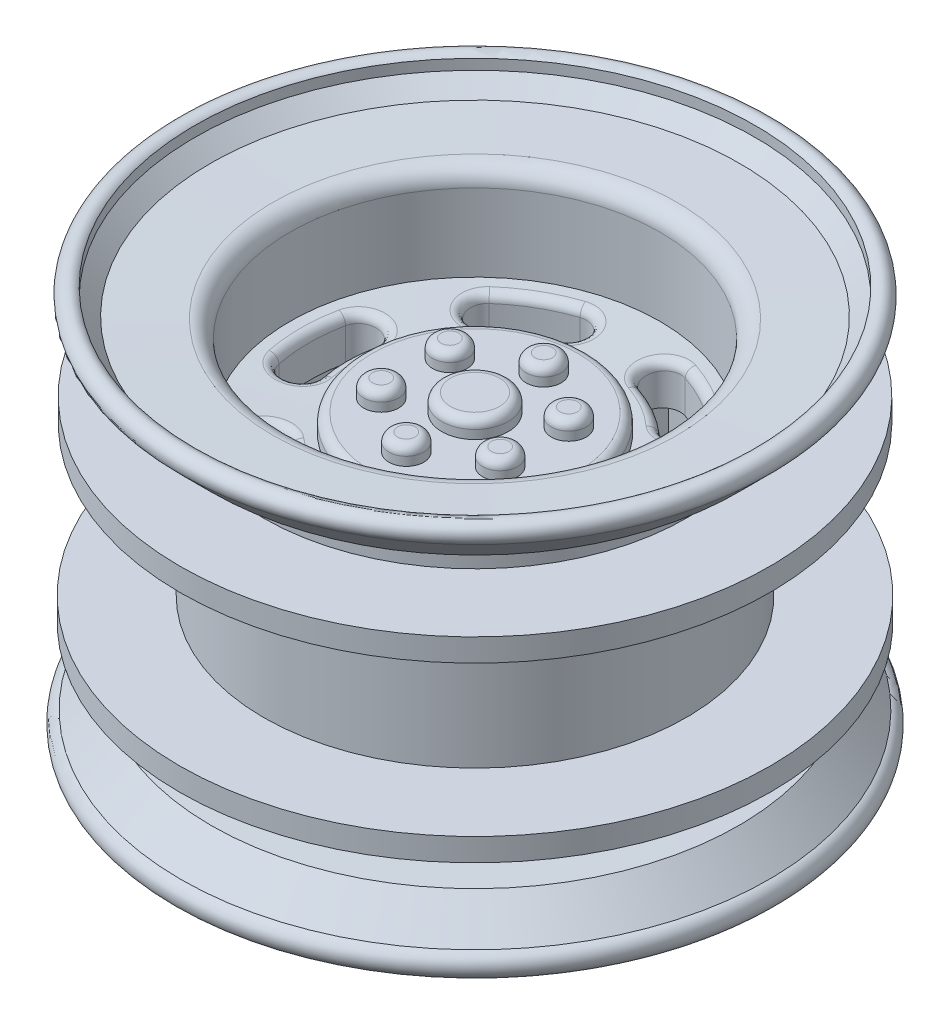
SolidWorks part; units mm, degrees
ref_plane "Plan1" through (0, 0, 0) normal (0, 0, 1) x (1, 0, 0)
ref_plane "Plan2" through (0, 0, 0) normal (0, 1, 0) x (1, 0, 0)
ref_plane "Plan3" through (0, 0, 0) normal (1, 0, 0) x (0, 0, -1)
sketch "Esquisse1" plane through (0, 0, 0) normal (0, 0, 1) x (1, 0, 0)
  line L0 (10.5795, 4) -> (6.3795, 3.7799)
  line L1 (11.5446, 9.4162) -> (15.1342, 9.5415)
  line L2 (15.1342, 9.5415) -> (16, 10.4073)
  line L3 (12.0795, -4.2837) -> (12.0795, 0)
  line L4 (16.8877, -4.2698) -> (12.0795, -4.2837)
  line L5 (16.8915, -5.5698) -> (16.8877, -4.2698)
  line L6 (16.8473, 10.1502) -> (15.0795, 8.3825)
  line L7 (15.0795, 8.3825) -> (12.0795, 8.3825)
  line L8 (12.0795, 8.3825) -> (12.0795, 5.5825)
  line L9 (12.0795, 5.5825) -> (16.8473, 5.5825)
  line L10 (16.8473, 5.5825) -> (16.8473, 4.2825)
  line L11 (16.8473, 4.2825) -> (12.0795, 4.2825)
  line L12 (12.0795, 4.2825) -> (12.0795, 0)
  line L13 (12.2228, -5.5833) -> (16.8915, -5.5698)
  line L14 (12.2228, -8.0833) -> (12.2228, -5.5833)
  line L15 (15.0738, -8.1338) -> (12.2228, -8.0833)
  line L16 (10.5795, 0) -> (10.5795, 1.604)
  line L17 (16.81, -9.9325) -> (15.0738, -8.1338)
  line L18 (14.5201, -9.52) -> (15.9988, -10.9987)
  line L19 (11.5446, -9.4161) -> (14.5201, -9.52)
  line L20 (10.5795, 0) -> (10.5795, -8.4167)
  line L21 (4, 1.604) -> (4, -17.9)
  line L22 (4, 1.604) -> (10.5795, 1.604)
  line L23 (6.3795, 3.7799) -> (6.353, 4.7795)
  line L24 (6.353, 4.7795) -> (0.0524, 4.7795)
  line L25 (0.0524, 4.7795) -> (0.0524, -17.9)
  line L26 (0.0524, -17.9) -> (4, -17.9)
  line L27 (10.5795, 4) -> (10.5795, 8.4168)
  line L28 (16, 11) -> (16, 10.4073)
  arc A0 (16.8473, 10.1502) -> (16, 11) centre (16.423, 10.5745) ccw
  arc A1 (16.81, -9.9325) -> (15.9988, -10.9987) centre (16.5965, -10.6118) cw
  arc A2 (10.5795, -8.4167) -> (11.5446, -9.4161) centre (11.5795, -8.4167) ccw
  arc A3 (10.5795, 8.4168) -> (11.5446, 9.4162) centre (11.5795, 8.4168) cw
  point P27 (10.5795, 9.3825)
  dimension "D6" = 0.6
  dimension "D14" = 1
  dimension "D15" = 1
  dimension "D1" = 135
  dimension "D2" = 2.5
  dimension "D3" = 3
  dimension "D4" = 2.8
  dimension "D5" = 1.3
  dimension "D7" = 2
  dimension "D8" = 1.5
  dimension "D9" = 11
  dimension "D10" = 16
  dimension "D11" = 1
  dimension "D12" = 1.3
  dimension "D13" = 4.2837
  dimension "D16" = 7
  dimension "D17" = 1
  dimension "D18" = 87
  dimension "D19" = 4
  dimension "D20" = 8.4167
  dimension "D21" = 4.2
  dimension "D22" = 28.9
  dimension "D23" = 2.5
ref_axis "Axe1" through (0, 50, 0) along (0, -1, 0)
revolve "Révolution2" add sketch "Esquisse1" angle 360 about axis through (0, 50, 0) along (0, -1, 0)
sketch "Esquisse3" plane through (0, 4.7795, 0) normal (0, 1, 0) x (-1, 0, 0)
  circle A0 centre (0, 0) radius 1.9
  dimension "D1" = 3.8
extrude "Extrusion1" add sketch "Esquisse3" along normal blind 1
sketch "Esquisse4" plane through (0, 4.7795, 0) normal (0, 1, 0) x (-1, 0, 0)
  circle A0 centre (0, -3.9244) radius 1
  dimension "D1" = 2
extrude "Extrusion2" add sketch "Esquisse4" along normal blind 1
fillet "Congé1" radius 0.5 3 edges at (0, 4.7795, 6.353) (0, 5.7795, 1.9) (0, 5.7795, -2.9244)
pattern_circular "Répétition circulaire1" count 6 over 360 about axis through (0, 0, 0) along (0, 1, 0) of "Extrusion2", "Congé1"
sketch "Esquisse5" plane through (0, 1.604, 0) normal (0, -1, 0) x (1, 0, 0)
  line L1 (0, 0) -> (0, -20.4062) construction
  arc A0 (9.3071, -1.9046) -> (9.3071, 1.9046) centre (0, 0) ccw
  arc A1 (9.3071, 1.9046) -> (7.3071, 1.4954) centre (8.3071, 1.7) ccw
  arc A2 (7.3071, 1.4954) -> (7.3071, -1.4954) centre (0, 0) cw
  arc A3 (9.3071, -1.9046) -> (7.3071, -1.4954) centre (8.3071, -1.7) cw
  dimension "D1" = 9.5
  dimension "D2" = 3.4
  dimension "D3" = 2
extrude "Enlèv. mat.-Extru.1" cut sketch "Esquisse5" against normal through all
fillet "Congé2" radius 0.5 4 edges at (8.2182, 3.8992, -2.7168) (7.4586, 3.8364, 0) (7.99, 3.8871, 2.6702) (9.5, 3.9434, 0)
pattern_circular "Répétition circulaire3" count 6 over 360 about axis through (0, 50, 0) along (0, -1, 0) of "Enlèv. mat.-Extru.1", "Congé2"
sketch "Esquisse7" plane through (0, 0, 0) normal (1, 0, 0) x (0, 0, -1)
  line L0 (10.8338, -7.606) -> (9.6367, -6.5029)
  line L1 (7.4679, -6.6458) -> (3.6101, -11.2754)
  line L2 (3.6101, -11.2754) -> (3.6101, 1.908)
  line L3 (3.6101, 1.908) -> (10.8338, 1.908)
  line L4 (10.8338, 1.908) -> (10.8338, -7.606)
  arc A0 (9.6367, -6.5029) -> (7.4679, -6.6458) centre (8.6202, -7.606) ccw
  dimension "D1" = 1.5
extrude "Extrusion9" add sketch "Esquisse7" along normal mid plane 1
fillet "Congé3" radius 0.2 8 edges at (0, -7.3717, -10.5795) (0, -10.8074, -4) (-0.5, -8.7454, -5.7182) (-0.5, -6.9319, -10.1022) (0.5, -8.7454, -5.7182) (0.5, -6.1093, -8.5216) (0.5, -6.9319, -10.1022) (-0.5, -6.1093, -8.5216)
pattern_circular "Répétition circulaire4" count 6 over 360 about axis through (0, 0, 0) along (0, 1, 0) of "Congé3", "Extrusion9"
sketch "Esquisse8" plane through (0, -17.9, 0) normal (0, -1, 0) x (1, 0, 0)
  circle A0 centre (0, 0) radius 1.95
  dimension "D1" = 3.9
extrude "Enlèv. mat.-Extru.2" cut sketch "Esquisse8" against normal blind 18.5
chamfer "Chanfrein1" distance 0.8 angle 45 1 edges at (0, -17.9, -1.95)
